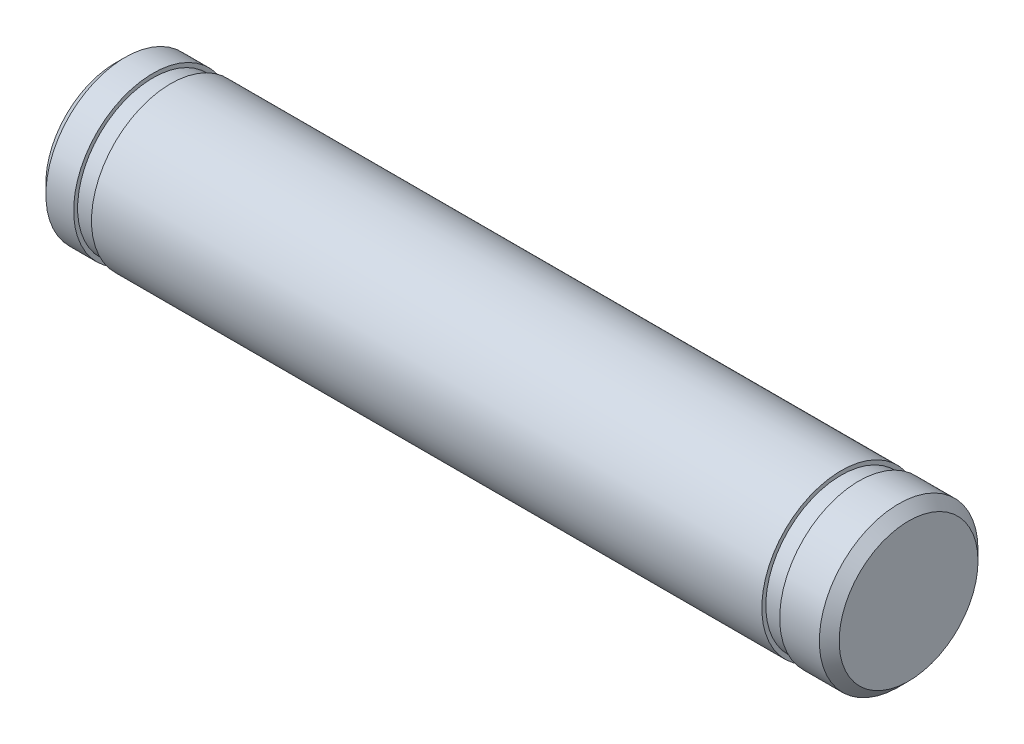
SolidWorks part; units mm, degrees
ref_plane "Face" through (0, 0, 0) normal (0, 0, 1) x (1, 0, 0)
ref_plane "Dessus" through (0, 0, 0) normal (0, 1, 0) x (1, 0, 0)
ref_plane "Droite" through (0, 0, 0) normal (1, 0, 0) x (0, 0, -1)
sketch "Esquisse1" plane through (0, 0, 0) normal (0, 0, 1) x (1, 0, 0)
  line L0 (124.2971, 0) -> (-48.5996, 0) construction
  line L1 (0, 0) -> (40, 0)
  line L2 (0, 0) -> (0, 3.5)
  line L3 (0.5, 4) -> (1.9, 4)
  line L4 (40, 0) -> (40, 3.5)
  line L5 (0, 3.5) -> (0.5, 4)
  line L6 (39.5, 4) -> (40, 3.5)
  line L7 (37.5, 4) -> (39.5, 4)
  line L9 (1.9, 4) -> (1.9, 3.8)
  line L10 (1.9, 3.8) -> (2.8, 3.8)
  line L11 (2.8, 4) -> (2.8, 3.8)
  line L12 (2.8, 4) -> (36.6, 4)
  line L13 (36.6, 4) -> (36.6, 3.8)
  line L14 (36.6, 3.8) -> (37.5, 3.8)
  line L15 (37.5, 4) -> (37.5, 3.8)
  point P1 (40, 4)
  point P2 (0, 4)
  dimension "D1" = 8
  dimension "D2" = 40
  dimension "D5" = 0.5
  dimension "D6" = 0.5
  dimension "D3" = 0.9
  dimension "D4" = 0.9
  dimension "D7" = 7.6
  dimension "D8" = 7.6
  dimension "D9" = 35.6
  dimension "D10" = 1.9
revolve "Révolution1" add sketch "Esquisse1" angle 360 about L0
